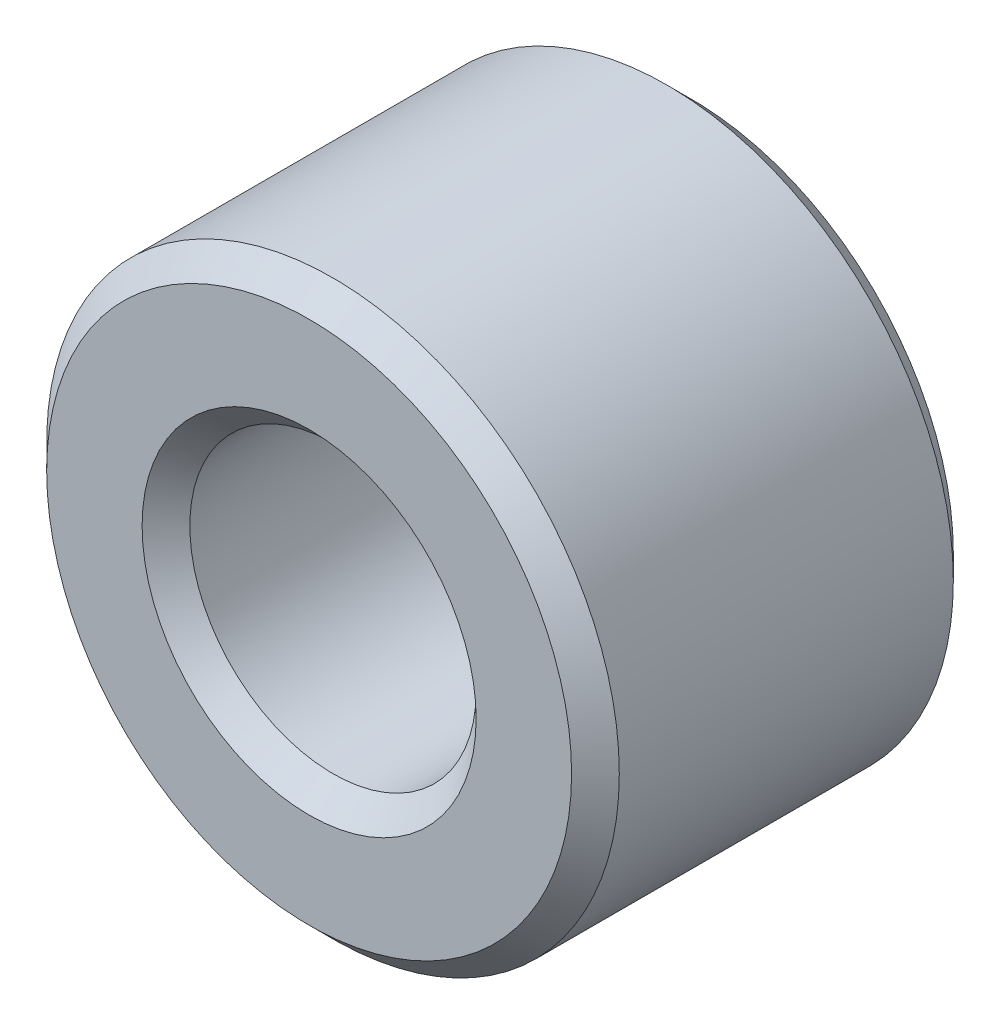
SolidWorks part; units mm, degrees
ref_plane "Front" through (0, 0, 0) normal (0, 0, 1) x (1, 0, 0)
ref_plane "Top" through (0, 0, 0) normal (0, 1, 0) x (1, 0, 0)
ref_plane "Right" through (0, 0, 0) normal (1, 0, 0) x (0, 0, -1)
sketch "Esquisse1" plane through (0, 0, 0) normal (0, 0, 1) x (1, 0, 0)
  circle A0 centre (0, 0) radius 3
  circle A1 centre (0, 0) radius 1.5
  dimension "D1" = 6
  dimension "D2" = 3
extrude "Boss.-Extru.1" add sketch "Esquisse1" along normal blind 4
chamfer "Chanfrein1" distance 0.25 angle 45 4 edges at (1.5, 0, 0) (1.5, 0, 4) (3, 0, 0) (3, 0, 4)
ref_plane "Plan1" through (0, 0, 2) normal (0, 0, 1) x (1, 0, 0)
